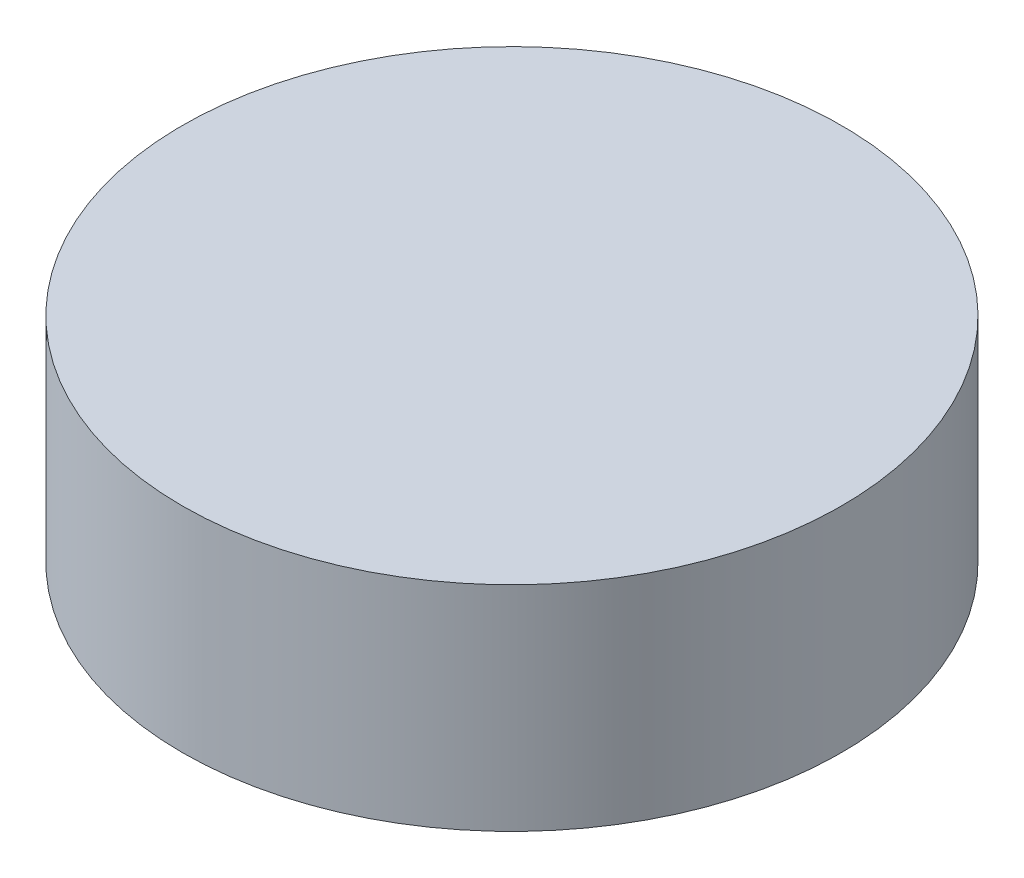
SolidWorks part; units mm, degrees
ref_plane "Front Plane" through (0, 0, 0) normal (0, 0, 1) x (1, 0, 0)
ref_plane "Top Plane" through (0, 0, 0) normal (0, 1, 0) x (1, 0, 0)
ref_plane "Right Plane" through (0, 0, 0) normal (1, 0, 0) x (0, 0, -1)
sketch "Sketch1"
extrude "Extrude1" add sketch "Sketch1" along normal blind 50.8
sketch "Sketch2"
  dimension "D1" = 25.4
  dimension "D2" = 20
